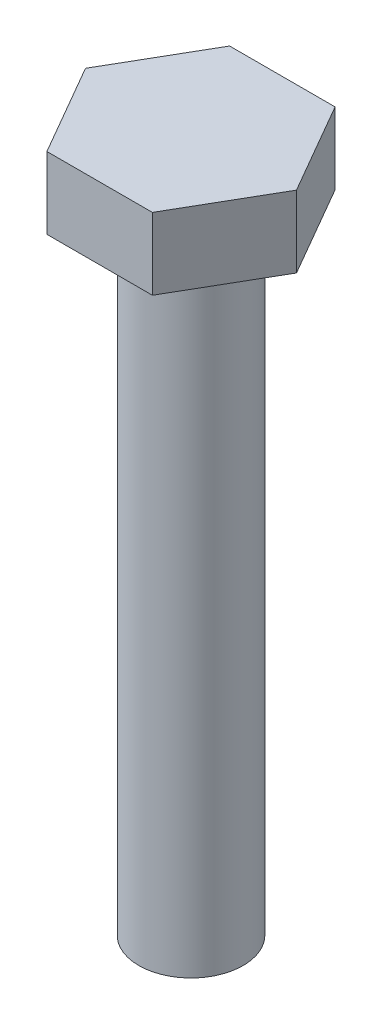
SolidWorks part; units mm, degrees
ref_plane "Front Plane" through (0, 0, 0) normal (0, 0, 1) x (1, 0, 0)
ref_plane "Top Plane" through (0, 0, 0) normal (0, 1, 0) x (1, 0, 0)
ref_plane "Right Plane" through (0, 0, 0) normal (1, 0, 0) x (0, 0, -1)
sketch "Sketch1" plane through (0, 0, 0) normal (0, 1, 0) x (1, 0, 0)
  circle A0 centre (0, 0) radius 3.175
  dimension "D1" = 6.35
extrude "Boss-Extrude1" add sketch "Sketch1" against normal blind 38.1
sketch "Sketch2" plane through (0, 0, 0) normal (0, 1, 0) x (1, 0, 0)
  line L1 (3.2079, -5.5563) -> (6.4158, 0)
  line L2 (6.4158, 0) -> (3.2079, 5.5563)
  line L3 (3.2079, 5.5563) -> (-3.2079, 5.5563)
  line L4 (-3.2079, 5.5563) -> (-6.4158, 0)
  line L5 (-6.4158, 0) -> (-3.2079, -5.5563)
  line L6 (-3.2079, -5.5563) -> (3.2079, -5.5563)
  circle A0 centre (0, 0) radius 5.5562 construction
  dimension "D1" = 11.1125
extrude "Boss-Extrude2" add sketch "Sketch2" along normal blind 4.3656
